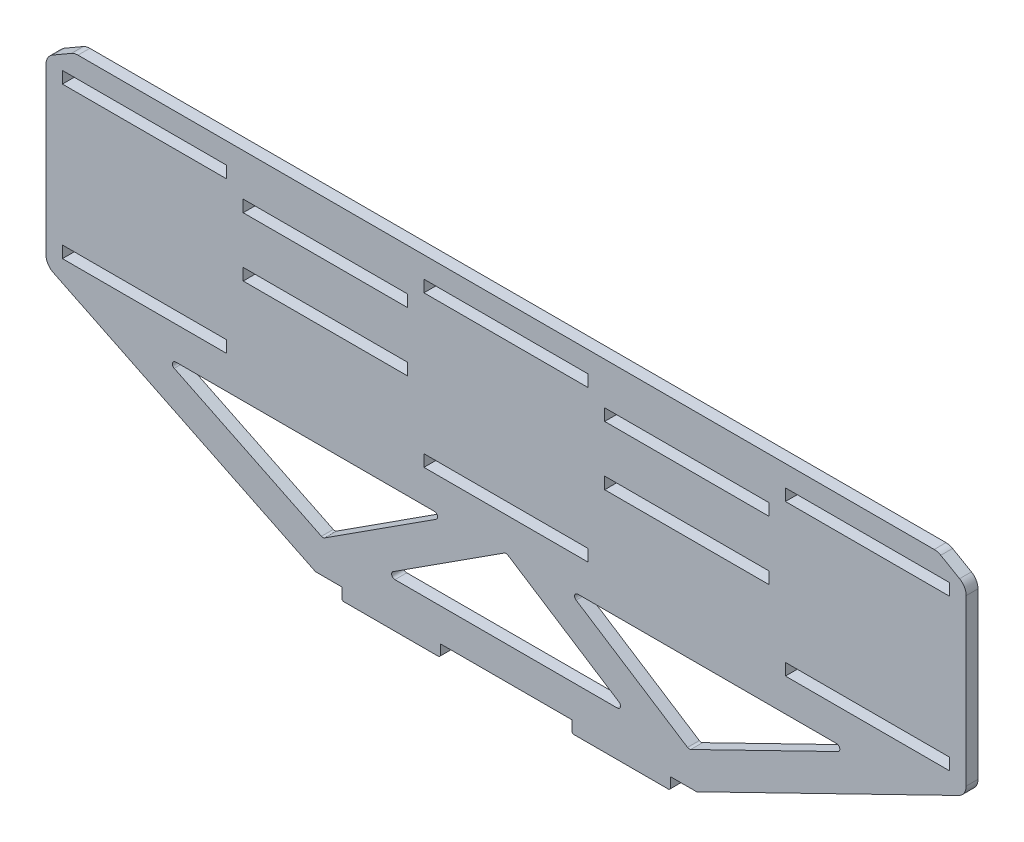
SolidWorks part; units mm, degrees
ref_plane "Alzado" through (0, 0, 0) normal (0, 0, 1) x (1, 0, 0)
ref_plane "Planta" through (0, 0, 0) normal (0, 1, 0) x (1, 0, 0)
ref_plane "Vista lateral" through (0, 0, 0) normal (1, 0, 0) x (0, 0, -1)
sketch "Croquis1" plane through (0, 0, 0) normal (0, 0, 1) x (1, 0, 0)
  line L1 (0, 0) -> (1400, 0)
  line L2 (0, 0) -> (0, 500)
  line L3 (0, 500) -> (1400, 500)
  line L4 (1400, 0) -> (1400, 500)
  dimension "D1" = 1400
  dimension "D2" = 500
extrude "Saliente-Extruir1" add sketch "Croquis1" along normal blind 18
sketch "Croquis2" plane through (0, 0, 18) normal (0, 0, 1) x (1, 0, 0)
  line L0 (700, 220) -> (700, 0) construction
  line L1 (25, 238) -> (275, 238)
  line L2 (25, 238) -> (25, 220)
  line L3 (25, 220) -> (275, 220)
  line L4 (275, 238) -> (275, 220)
  line L5 (575, 238) -> (825, 238)
  line L6 (575, 238) -> (575, 220)
  line L7 (575, 220) -> (825, 220)
  line L8 (825, 238) -> (825, 220)
  line L9 (1125, 238) -> (1375, 238)
  line L10 (1125, 238) -> (1125, 220)
  line L11 (1125, 220) -> (1375, 220)
  line L12 (1375, 238) -> (1375, 220)
  line L13 (1375, 450) -> (1125, 450)
  line L14 (1375, 450) -> (1375, 468)
  line L15 (1375, 468) -> (1125, 468)
  line L16 (1125, 450) -> (1125, 468)
  line L17 (825, 468) -> (575, 468)
  line L18 (825, 468) -> (825, 450)
  line L19 (825, 450) -> (575, 450)
  line L20 (575, 468) -> (575, 450)
  line L21 (275, 450) -> (25, 450)
  line L22 (275, 450) -> (275, 468)
  line L23 (275, 468) -> (25, 468)
  line L24 (25, 450) -> (25, 468)
  line L25 (0, 0) -> (1400, 0) construction
  point P28 (575, 229)
  dimension "D1" = 18
  dimension "D2" = 18
  dimension "D3" = 250
  dimension "D4" = 250
  dimension "D5" = 250
  dimension "D6" = 300
  dimension "D7" = 300
  dimension "D8" = 450
  dimension "D9" = 220
extrude "Cortar-Extruir1" cut sketch "Croquis2" against normal through all
chamfer "Chaflán1" distance 200 angle 64 2 edges at (1400, 0, 9) (0, 0, 9)
sketch "Croquis4" plane through (0, 0, 0) normal (0, -1, 0) x (1, 0, 0)
  line L0 (410.0608, 18) -> (989.9392, 18) construction
  line L1 (450, 18) -> (600, 18)
  line L2 (450, 18) -> (450, 0)
  line L3 (450, 0) -> (600, 0)
  line L4 (600, 18) -> (600, 0)
  line L5 (410.0608, 0) -> (989.9392, 0) construction
  line L6 (800, 9) -> (600, 9) construction
  line L7 (950, 18) -> (800, 18)
  line L8 (950, 18) -> (950, 0)
  line L9 (950, 0) -> (800, 0)
  line L10 (800, 18) -> (800, 0)
  line L11 (700, 9) -> (700, 18) construction
  dimension "D1" = 150
  dimension "D2" = 150
  dimension "D3" = 200
extrude "Saliente-Extruir2" add sketch "Croquis4" along normal blind 18
sketch "Croquis5" plane through (0, 0, 18) normal (0, 0, 1) x (1, 0, 0)
  line L0 (175.5677, 170) -> (421.6042, 50)
  line L1 (421.6042, 50) -> (607.7275, 170)
  line L2 (607.7275, 170) -> (175.5677, 170)
  line L3 (700, 170) -> (513.8767, 50)
  line L4 (513.8767, 50) -> (886.1233, 50)
  line L5 (700, 500) -> (700, 0) construction
  line L6 (1400, 500) -> (0, 500) construction
  line L7 (600, 0) -> (800, 0) construction
  line L8 (0, 200) -> (410.0608, 0) construction
  line L9 (575, 220) -> (825, 220) construction
  line L10 (792.2725, 170) -> (1224.4323, 170)
  line L11 (1224.4323, 170) -> (978.3958, 50)
  line L12 (978.3958, 50) -> (792.2725, 170)
  line L13 (700, 170) -> (886.1233, 50)
  point P26 (700, 50)
  dimension "D1" = 50
  dimension "D2" = 50
  dimension "D3" = 50
  dimension "D4" = 50
extrude "Cortar-Extruir3" cut sketch "Croquis5" against normal through all
chamfer "Chaflán2" distance 25 angle 60 2 edges at (1400, 500, 9) (0, 500, 9)
sketch "Croquis6" plane through (0, 0, 18) normal (0, 0, 1) x (1, 0, 0)
  line L0 (850, 328) -> (550, 328) construction
  line L1 (300, 346) -> (550, 346)
  line L2 (300, 346) -> (300, 328)
  line L3 (300, 328) -> (550, 328)
  line L4 (550, 346) -> (550, 328)
  line L5 (850, 346) -> (1100, 346)
  line L6 (850, 346) -> (850, 328)
  line L7 (850, 328) -> (1100, 328)
  line L8 (1100, 346) -> (1100, 328)
  line L9 (700, 328) -> (700, 238) construction
  line L10 (825, 238) -> (575, 238) construction
  line L11 (1375, 238) -> (1125, 238) construction
  line L13 (300, 418) -> (550, 418)
  line L14 (300, 418) -> (300, 436)
  line L15 (300, 436) -> (550, 436)
  line L16 (550, 418) -> (550, 436)
  line L17 (850, 436) -> (1100, 436)
  line L18 (850, 436) -> (850, 418)
  line L19 (850, 418) -> (1100, 418)
  line L20 (1100, 436) -> (1100, 418)
  dimension "D1" = 250
  dimension "D2" = 250
  dimension "D3" = 300
  dimension "D4" = 18
  dimension "D5" = 90
  dimension "D6" = 18
  dimension "D7" = 90
extrude "Cortar-Extruir4" cut sketch "Croquis6" against normal through all
fillet "Redondeo1" radius 20 6 edges at (1400, 200, 9) (0, 200, 9) (1400, 475, 9) (1356.6987, 500, 9) (0, 475, 9) (43.3013, 500, 9)
fillet "Redondeo2" radius 5 9 edges at (978.3958, 50, 9) (1224.4323, 170, 9) (792.2725, 170, 9) (886.1233, 50, 9) (513.8767, 50, 9) (421.6042, 50, 9) (175.5677, 170, 9) (700, 170, 9) (607.7275, 170, 9)
chamfer "Chaflán3" distance 2 angle 45 4 edges at (950, -18, 9) (800, -18, 9) (600, -18, 9) (450, -18, 9)
